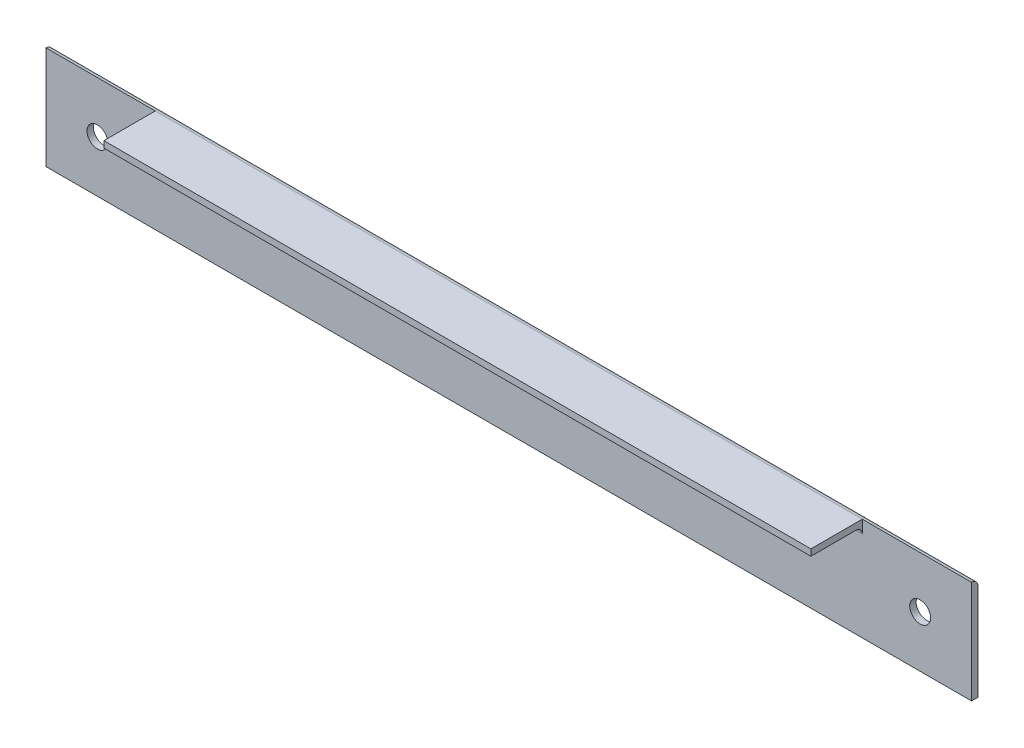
SolidWorks part; units mm, degrees
ref_plane "Front Plane" through (0, 0, 0) normal (0, 0, 1) x (1, 0, 0)
ref_plane "Top Plane" through (0, 0, 0) normal (0, 1, 0) x (1, 0, 0)
ref_plane "Right Plane" through (0, 0, 0) normal (1, 0, 0) x (0, 0, -1)
sketch "Sketch1" plane through (0, 0, 0) normal (0, 0, 1) x (1, 0, 0)
  line L1 (0, 0) -> (-914.4, 0)
  line L2 (0, 0) -> (0, -101.6)
  line L3 (0, -101.6) -> (-914.4, -101.6)
  line L4 (-914.4, 0) -> (-914.4, -101.6)
  dimension "D1" = 914.4
  dimension "D2" = 101.6
extrude "Extrude1" add sketch "Sketch1" along normal blind 6.35
sketch "Sketch2" plane through (0, 0, 6.35) normal (0, 0, 1) x (1, 0, 0)
  line L0 (0, -101.6) -> (0, 0) construction
  line L1 (0, 0) -> (-914.4, 0) construction
  circle A0 centre (-863.6, -50.8) radius 10.3188
  dimension "D1" = 20.6375
  dimension "D2" = 863.6
  dimension "D3" = 50.8
extrude "Cut-Extrude1" cut sketch "Sketch2" against normal blind 6.35
sketch "Sketch3" plane through (0, 0, 6.35) normal (0, 0, 1) x (1, 0, 0)
  line L0 (0, -101.6) -> (0, 0) construction
  line L1 (0, 0) -> (-914.4, 0) construction
  circle A0 centre (-50.8, -50.8) radius 10.3188
  dimension "D1" = 20.6375
  dimension "D2" = 50.8
  dimension "D3" = 50.8
extrude "Cut-Extrude2" cut sketch "Sketch3" against normal blind 6.35
sketch "Sketch4" plane through (0, 0, 6.35) normal (0, 0, 1) x (1, 0, 0)
  line L0 (0, 0) -> (-914.4, 0) construction
  line L1 (-107.95, 0) -> (-806.45, 0)
  line L2 (-107.95, 0) -> (-107.95, -6.35)
  line L3 (-107.95, -6.35) -> (-806.45, -6.35)
  line L4 (-806.45, 0) -> (-806.45, -6.35)
  line L5 (0, -101.6) -> (0, 0) construction
  dimension "D1" = 107.95
  dimension "D2" = 806.45
  dimension "D3" = 6.35
extrude "Extrude4" add sketch "Sketch4" along normal blind 50.8
fillet "Fillet2" radius 6.35 2 edges at (-457.2, -6.35, 6.35) (-457.2, 0, 0)
